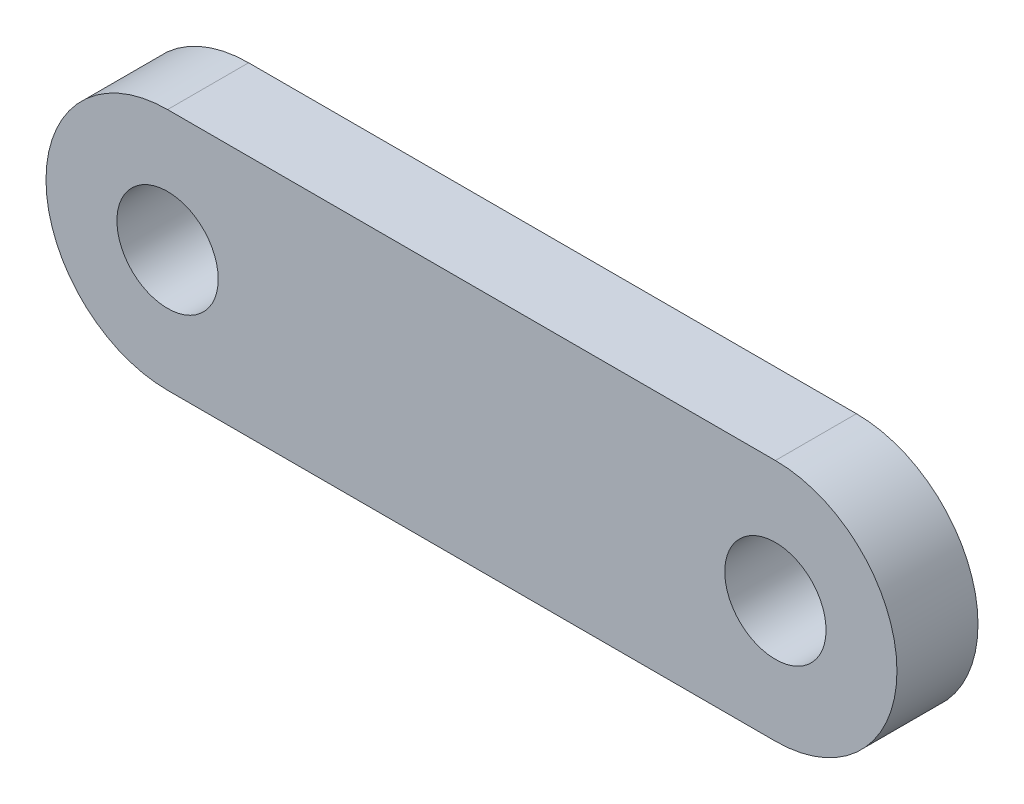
SolidWorks part; units mm, degrees
ref_plane "前视基准面" through (0, 0, 0) normal (0, 0, 1) x (1, 0, 0)
ref_plane "上视基准面" through (0, 0, 0) normal (0, 1, 0) x (1, 0, 0)
ref_plane "右视基准面" through (0, 0, 0) normal (1, 0, 0) x (0, 0, -1)
sketch "草图1" plane through (0, 0, 0) normal (0, 0, 1) x (1, 0, 0)
  line L0 (-15, 0) -> (15, 0) construction
  line L1 (-15, 6) -> (15, 6)
  line L2 (-15, -6) -> (15, -6)
  arc A0 (-15, 6) -> (-15, -6) centre (-15, 0) ccw
  arc A1 (15, -6) -> (15, 6) centre (15, 0) ccw
  circle A2 centre (-15, 0) radius 2.5
  circle A3 centre (15, 0) radius 2.5
  point P2 (0, 0)
extrude "凸台-拉伸1" add sketch "草图1" along normal blind 4
